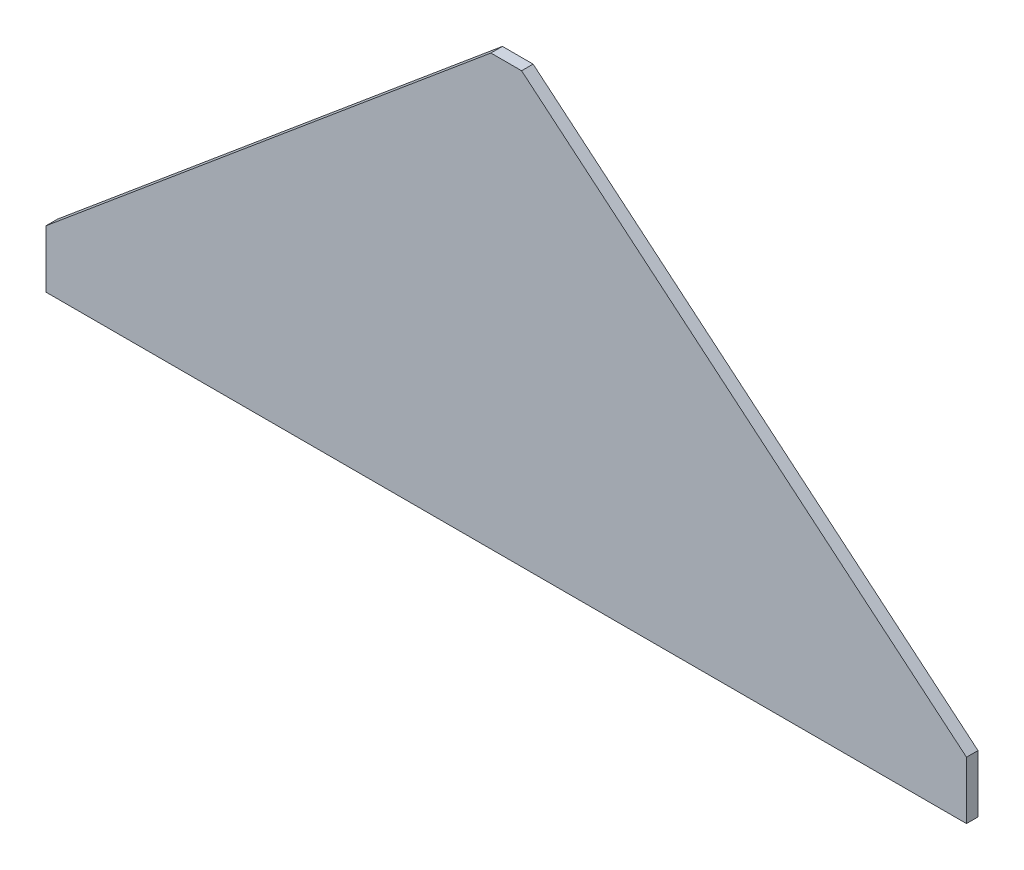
SolidWorks part; units mm, degrees
ref_plane "Plan de face" through (0, 0, 0) normal (0, 0, 1) x (1, 0, 0)
ref_plane "Plan de dessus" through (0, 0, 0) normal (0, 1, 0) x (1, 0, 0)
ref_plane "Plan de droite" through (0, 0, 0) normal (1, 0, 0) x (0, 0, -1)
sketch "Esquisse1" plane through (0, 0, 0) normal (0, 0, 1) x (1, 0, 0)
  line L1 (0, 0) -> (240, 0)
  line L2 (0, 0) -> (0, 112)
  line L3 (0, 112) -> (240, 112)
  line L4 (240, 0) -> (240, 112)
  dimension "D1" = 240
  dimension "D2" = 112
extrude "Extrusion1" add sketch "Esquisse1" along normal blind 3
sketch "Esquisse2" plane through (0, 0, 3) normal (0, 0, 1) x (1, 0, 0)
  line L0 (0, 15) -> (116, 112)
  line L1 (0, 112) -> (0, 0) construction
  line L2 (240, 112) -> (0, 112) construction
  line L3 (116, 112) -> (0, 112)
  line L4 (0, 112) -> (0, 15)
  line L5 (240, 15) -> (124, 112)
  line L6 (240, 0) -> (240, 112) construction
  line L7 (124, 112) -> (240, 112)
  line L8 (240, 112) -> (240, 15)
  dimension "D1" = 97
  dimension "D2" = 116
  dimension "D3" = 116
  dimension "D4" = 97
extrude "Enlèv. mat.-Extru.1" cut sketch "Esquisse2" against normal blind 3
